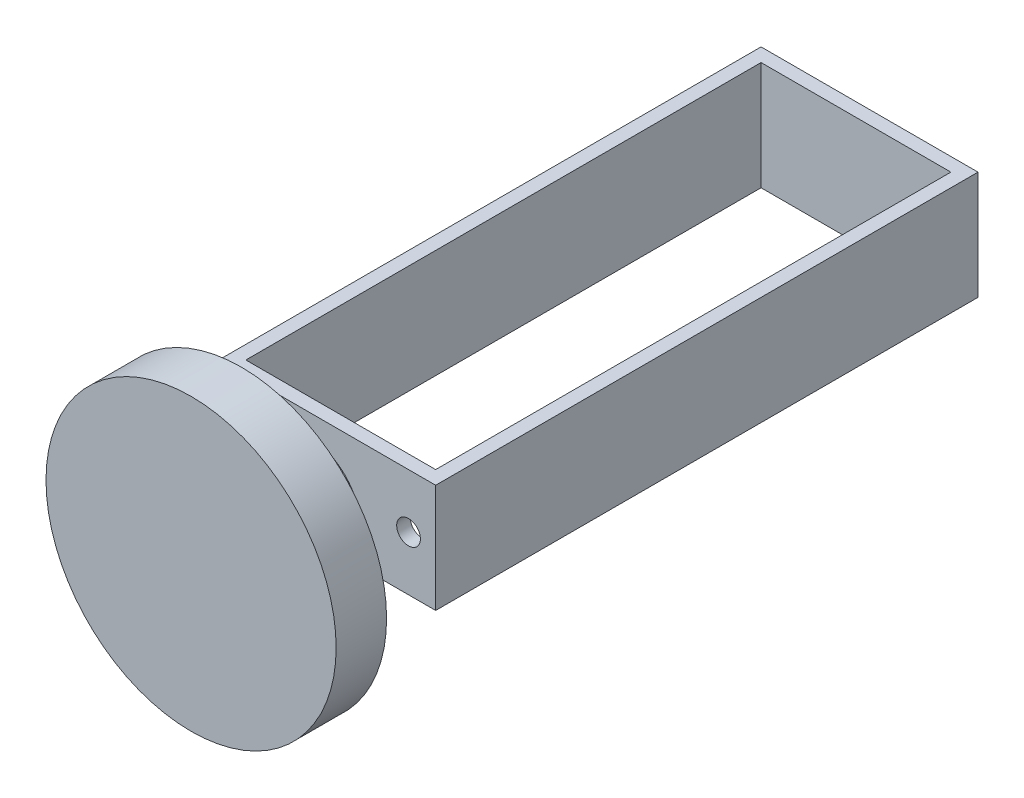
SolidWorks part; units mm, degrees
ref_plane "Front Plane" through (0, 0, 0) normal (0, 0, 1) x (1, 0, 0)
ref_plane "Top Plane" through (0, 0, 0) normal (0, 1, 0) x (1, 0, 0)
ref_plane "Right Plane" through (0, 0, 0) normal (1, 0, 0) x (0, 0, -1)
sketch "Sketch1" plane through (0, 0, 0) normal (0, 1, 0) x (1, 0, 0)
  line L0 (-22.225, 60.325) -> (22.225, 60.325)
  line L1 (-25.4, -63.5) -> (25.4, -63.5)
  line L2 (-25.4, -63.5) -> (-25.4, 63.5)
  line L3 (-25.4, 63.5) -> (25.4, 63.5)
  line L4 (25.4, -63.5) -> (25.4, 63.5)
  line L5 (-25.4, -63.5) -> (25.4, 63.5) construction
  line L6 (-25.4, 63.5) -> (25.4, -63.5) construction
  line L7 (22.225, -60.325) -> (22.225, 60.325)
  line L8 (-22.225, -60.325) -> (22.225, -60.325)
  line L9 (-22.225, -60.325) -> (-22.225, 60.325)
  point P0 (0, 0)
  dimension "D1" = 3.175
extrude "Boss-Extrude1" add sketch "Sketch1" along normal blind 25.4
sketch "Sketch2" plane through (0, 0, 63.5) normal (0, 0, 1) x (1, 0, 0)
  line L0 (-25.4, 25.4) -> (25.4, 25.4) construction
  line L1 (-25.4, 25.4) -> (-25.4, 0) construction
  line L2 (25.4, 25.4) -> (25.4, 0) construction
  circle A0 centre (0, 12.7) radius 6.35
  circle A1 centre (-19.05, 12.7) radius 2.7781
  circle A2 centre (19.05, 12.7) radius 2.7781
  point P12 (0, 0)
  point P13 (0, 0)
  dimension "D1" = 12.7
  dimension "D4" = 5.5562
  dimension "D5" = 12.7
  dimension "D6" = 5.5562
  dimension "D2" = 50.8
  dimension "D3" = 19.05
extrude "Cut-Extrude1" cut sketch "Sketch2" against normal blind 25.4 contours A1 | A2
sketch "Sketch3" plane through (0, 0, 63.5) normal (0, 0, 1) x (1, 0, 0)
  circle A0 centre (0, 12.7) radius 5.588
extrude "Boss-Extrude2" add sketch "Sketch3" along normal blind 4.826
sketch "Sketch4" plane through (0, 0, 68.326) normal (0, 0, 1) x (1, 0, 0)
  line L0 (0, 18.288) -> (0, 7.112)
  circle A0 centre (0, 12.7) radius 5.588 construction
  circle A1 centre (0, 12.7) radius 5.588 construction
  circle A2 centre (0, 12.7) radius 12.7
extrude "Boss-Extrude3" add sketch "Sketch4" along normal blind 15.24 contours A2 M2 | L0 M2 | L0 M2
sketch "Sketch5" plane through (0, 0, 83.566) normal (0, 0, 1) x (1, 0, 0)
  line L0 (0, 25.4) -> (0, 0)
  line L1 (-25.4, 25.4) -> (25.4, 25.4) construction
  circle A0 centre (0, 12.7) radius 33.9725
extrude "Boss-Extrude4" add sketch "Sketch5" along normal blind 11.811 contours A0 M1 | L0 M1 | L0 M1
